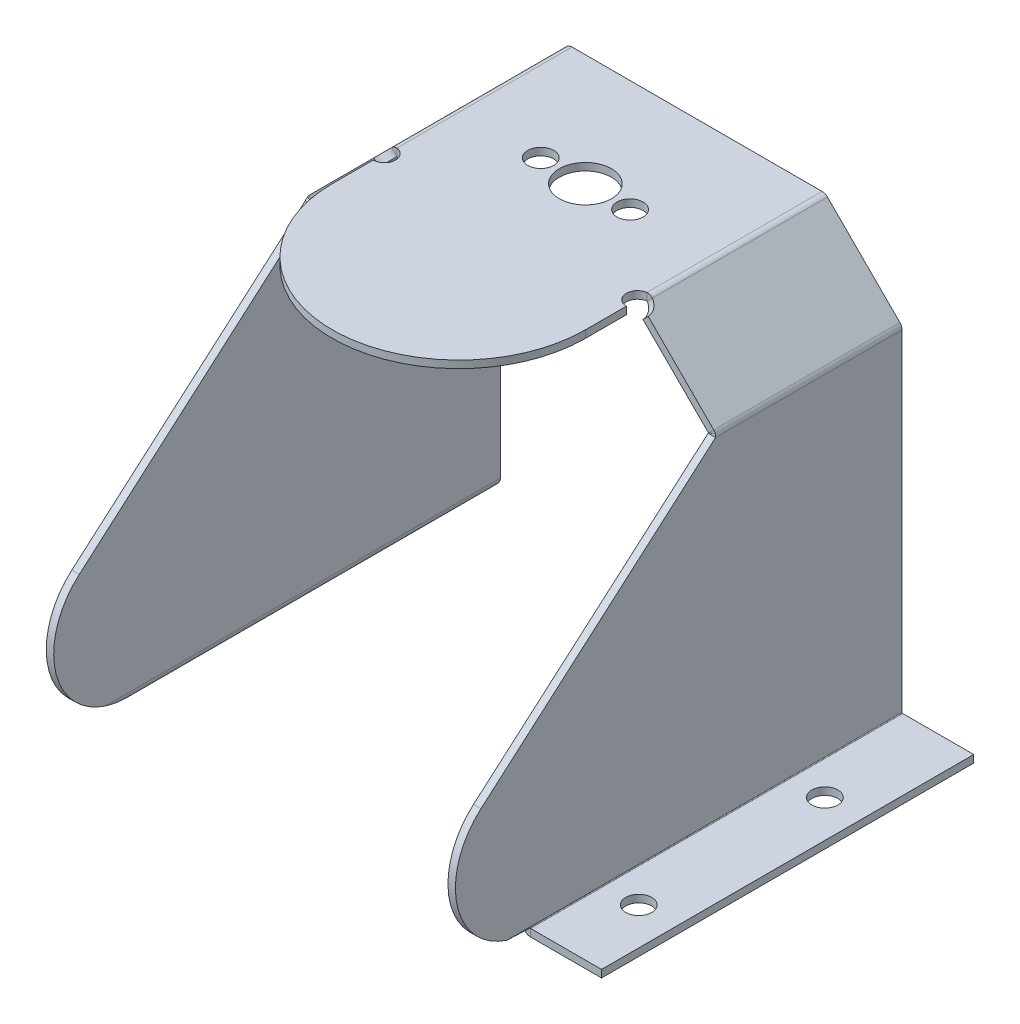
SolidWorks part; units mm, degrees
ref_plane "Front" through (0, 0, 0) normal (0, 0, 1) x (1, 0, 0)
ref_plane "Top" through (0, 0, 0) normal (0, 1, 0) x (1, 0, 0)
ref_plane "Right" through (0, 0, 0) normal (1, 0, 0) x (0, 0, -1)
sketch "Sketch1" plane through (0, 0, 0) normal (0, 1, 0) x (1, 0, 0)
  line L0 (-86, 0) -> (86, 0)
  line L1 (31, -25) -> (18.5, -25)
  line L2 (17, -26.5) -> (17, -32)
  line L4 (-31, -25) -> (-58.455, -56.563)
  line L5 (-31, -25) -> (-18.5, -25)
  line L6 (86, -50) -> (76, -50)
  line L7 (-86, 0) -> (-86, -50)
  line L8 (86, 0) -> (86, -50)
  line L9 (-86, -50) -> (-76, -50)
  line L10 (31, -25) -> (58.455, -56.563)
  line L22 (-17, -26.5) -> (-17, -32)
  arc A0 (-76, -50) -> (-58.455, -56.563) centre (-66, -50) ccw
  arc A1 (-17, -26.5) -> (-18.5, -25) centre (-17, -25) ccw
  circle A2 centre (-81, -15) radius 1.75
  arc A3 (-17, -32) -> (17, -32) centre (0, -32) ccw
  circle A4 centre (-81, -40) radius 1.75
  circle A5 centre (0, -15) radius 3.5
  circle A6 centre (-6, -15) radius 1.75
  circle A7 centre (6, -15) radius 1.75
  circle A8 centre (81, -40) radius 1.75
  circle A9 centre (81, -15) radius 1.75
  arc A10 (17, -26.5) -> (18.5, -25) centre (17, -25) cw
  arc A11 (76, -50) -> (58.455, -56.563) centre (66, -50) cw
sheet metal parameters "Sheet-Metal1" thickness 1 parameters "D1"=3
base flange "Base-Flange1" sketch "Sketch1" thickness 1 reverse thickness direction yes parameters "D1"=3
sketch "Sketch3" plane through (0, 1, 0) normal (0, 1, 0) x (-1, 0, 0)
  line L0 (-76, 50) -> (-76, 0)
  line L1 (-86, 0) -> (86, 0) construction
  line L2 (76, 50) -> (76, 0)
sketched bend "Sketched Bend2" parameters "D1"=0.1
bend "SketchBend3" bend radius 0.1 bend angle 90 parameters "D5"=1
bend "SketchBend4" bend radius 0.1 bend angle 90 parameters "D5"=2
sketch "Sketch5" plane through (0, 1, 0) normal (0, 1, 0) x (-1, 0, 0)
  line L0 (-31, 25) -> (-31, 0)
  line L1 (-75.5288, 0) -> (75.5288, 0) construction
  line L2 (31, 25) -> (31, 0)
  line L3 (17, 23.5) -> (17, 0)
  line L4 (-17, 23.5) -> (-17, 0)
  line L5 (-17, 25) -> (-17, 0) construction
  line L6 (17, 25) -> (17, 0) construction
sketched bend "Sketched Bend4" parameters "D1"=0.01
bend "SketchBend9" bend radius 0.01 bend angle 45 parameters "D5"=3
bend "SketchBend10" bend radius 0.01 bend angle 45 parameters "D5"=4
bend "SketchBend11" bend radius 0.01 bend angle 45 parameters "D5"=5
bend "SketchBend12" bend radius 0.01 bend angle 45 parameters "D5"=6
flat pattern "Flat-Pattern1"
sketch "Bend-Lines1" plane through (0, 1, 0) normal (0, 1, 0) x (-1, 0, 0)
  line L0 (-17, 0) -> (-17, 23.5) construction
  line L1 (17, 0) -> (17, 23.5) construction
  line L2 (31, 0) -> (31, 25) construction
  line L3 (-31, 0) -> (-31, 25) construction
  line L4 (76, 0) -> (76, 50) construction
  line L5 (-76, 0) -> (-76, 50) construction
bend of the flat pattern "Flatten-<SketchBend3>1"
bend of the flat pattern "Flatten-<SketchBend4>1"
bend of the flat pattern "Flatten-<SketchBend9>1"
bend of the flat pattern "Flatten-<SketchBend10>1"
bend of the flat pattern "Flatten-<SketchBend11>1"
bend of the flat pattern "Flatten-<SketchBend12>1"
